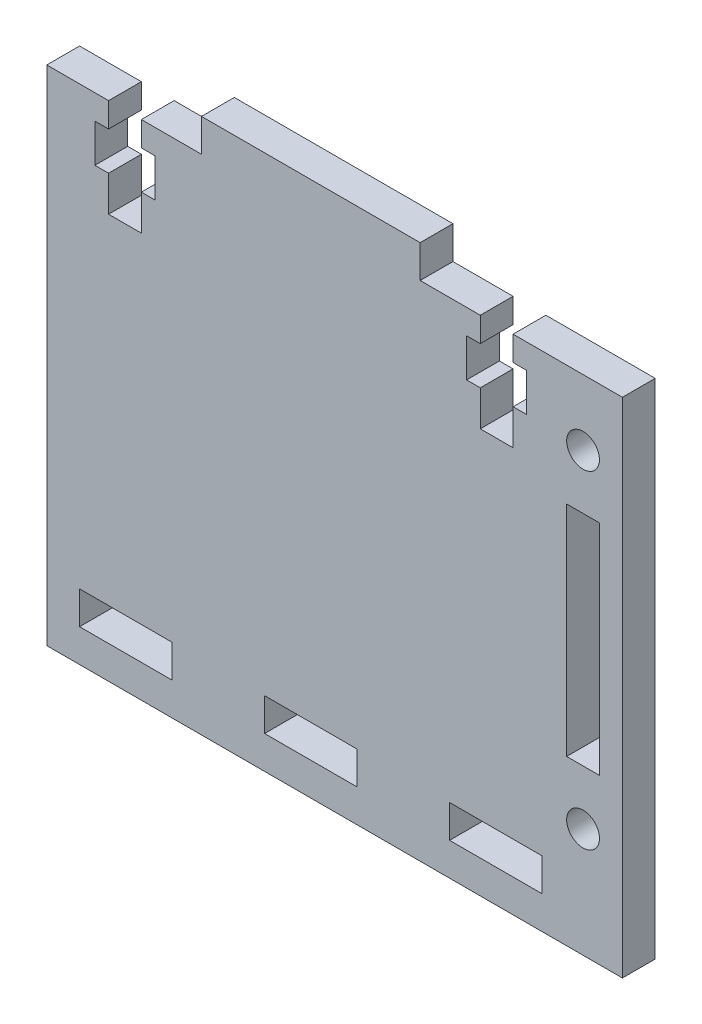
SolidWorks part; units mm, degrees
ref_plane "Front Plane" through (0, 0, 0) normal (0, 0, 1) x (1, 0, 0)
ref_plane "Top Plane" through (0, 0, 0) normal (0, 1, 0) x (1, 0, 0)
ref_plane "Right Plane" through (0, 0, 0) normal (1, 0, 0) x (0, 0, -1)
sketch "Sketch2" plane through (0, 0, 0) normal (0, 0, 1) x (1, 0, 0)
  line L0 (-19.175, -975.5) -> (-19.175, 49024.5) construction
  line L1 (14.825, -975.5) -> (14.825, 49024.5) construction
  line L2 (-20.675, 12.5) -> (-17.675, 12.5)
  line L3 (-20.675, 12.5) -> (-20.675, 24.5)
  line L4 (-20.675, 24.5) -> (-17.675, 24.5)
  line L5 (7.825, 24.5) -> (-12.175, 24.5)
  line L6 (-12.175, 24.5) -> (-12.175, 21.5)
  line L7 (-12.175, 21.5) -> (7.825, 21.5)
  line L8 (7.825, 21.5) -> (7.825, 24.5)
  line L9 (-17.675, 12.5) -> (-17.675, 24.5)
  line L10 (-20.675, 12.5) -> (-17.675, 24.5) construction
  line L11 (-20.675, 24.5) -> (-17.675, 12.5) construction
  line L12 (13.325, 12.5) -> (16.325, 12.5)
  line L13 (13.325, 12.5) -> (13.325, 24.5)
  line L14 (13.325, 24.5) -> (16.325, 24.5)
  line L15 (16.325, 12.5) -> (16.325, 24.5)
  line L16 (13.325, 12.5) -> (16.325, 24.5) construction
  line L17 (13.325, 24.5) -> (16.325, 12.5) construction
  line L18 (26.325, 21.5) -> (-26.325, 21.5)
  line L19 (26.325, 21.5) -> (26.325, -24.5)
  line L20 (26.325, -24.5) -> (-26.325, -24.5)
  line L21 (-26.325, 21.5) -> (-26.325, -24.5)
  line L22 (-6.405, -18.5) -> (2.055, -18.5)
  line L23 (22.725, 24.5) -> (22.725, -8.7762) construction
  line L24 (-23.325, -18.5) -> (-14.865, -18.5)
  line L25 (-1015.925, -18.5) -> (48984.075, -18.5) construction
  line L26 (-23.325, -18.5) -> (-23.325, -21.5)
  line L27 (-23.325, -21.5) -> (-14.865, -21.5)
  line L28 (-14.865, -18.5) -> (-14.865, -21.5)
  line L29 (-6.405, -18.5) -> (-6.405, -21.5)
  line L30 (-6.405, -21.5) -> (2.055, -21.5)
  line L31 (2.055, -18.5) -> (2.055, -21.5)
  line L32 (10.515, -18.5) -> (18.975, -18.5)
  line L33 (10.515, -18.5) -> (10.515, -21.5)
  line L34 (10.515, -21.5) -> (18.975, -21.5)
  line L35 (18.975, -18.5) -> (18.975, -21.5)
  line L36 (21.225, 10.5) -> (24.225, 10.5)
  line L37 (21.225, 10.5) -> (21.225, -9.5)
  line L38 (21.225, -9.5) -> (24.225, -9.5)
  line L39 (24.225, 10.5) -> (24.225, -9.5)
  line L40 (12.075, 15.75) -> (17.575, 15.75)
  line L41 (12.075, 15.75) -> (12.075, 19.25)
  line L42 (12.075, 19.25) -> (17.575, 19.25)
  line L43 (17.575, 15.75) -> (17.575, 19.25)
  line L44 (12.075, 15.75) -> (17.575, 19.25) construction
  line L45 (12.075, 19.25) -> (17.575, 15.75) construction
  line L46 (-21.925, 15.75) -> (-16.425, 15.75)
  line L47 (-21.925, 15.75) -> (-21.925, 19.25)
  line L48 (-21.925, 19.25) -> (-16.425, 19.25)
  line L49 (-16.425, 15.75) -> (-16.425, 19.25)
  line L50 (-21.925, 15.75) -> (-16.425, 19.25) construction
  line L51 (-21.925, 19.25) -> (-16.425, 15.75) construction
  circle A0 centre (22.725, 15.5) radius 1.5
  circle A1 centre (22.725, -14.5) radius 1.5
  point P6 (-19.175, 18.5)
  point P13 (14.825, 18.5)
  point P43 (22.725, 10.5)
  point P47 (14.825, 17.5)
  point P52 (-19.175, 17.5)
  dimension "D13" = 3
  dimension "D1" = 12
  dimension "D2" = 3
  dimension "D3" = 3
  dimension "D4" = 46
  dimension "D5" = 10
  dimension "D6" = 3
  dimension "D7" = 8.46
  dimension "D8" = 20
  dimension "D9" = 3
  dimension "D10" = 11
  dimension "D11" = 5
  dimension "D12" = 5
  dimension "D14" = 5.5
  dimension "D15" = 3.5
  dimension "D16" = 4
  dimension "D17" = 5.5
extrude "Boss-Extrude1" add sketch "Sketch2" along normal blind 3 contours L49 L46 L9 L2 L3 L47 L48 L18 L21 L20 L19 L15 L42 L43 L40 L12 L13 L41 L7 A1 A0 L24 L28 L27 L26 L22 L31 L30 L29 L32 L35 L34 L33 L36 | L7 L8 L5 L6
